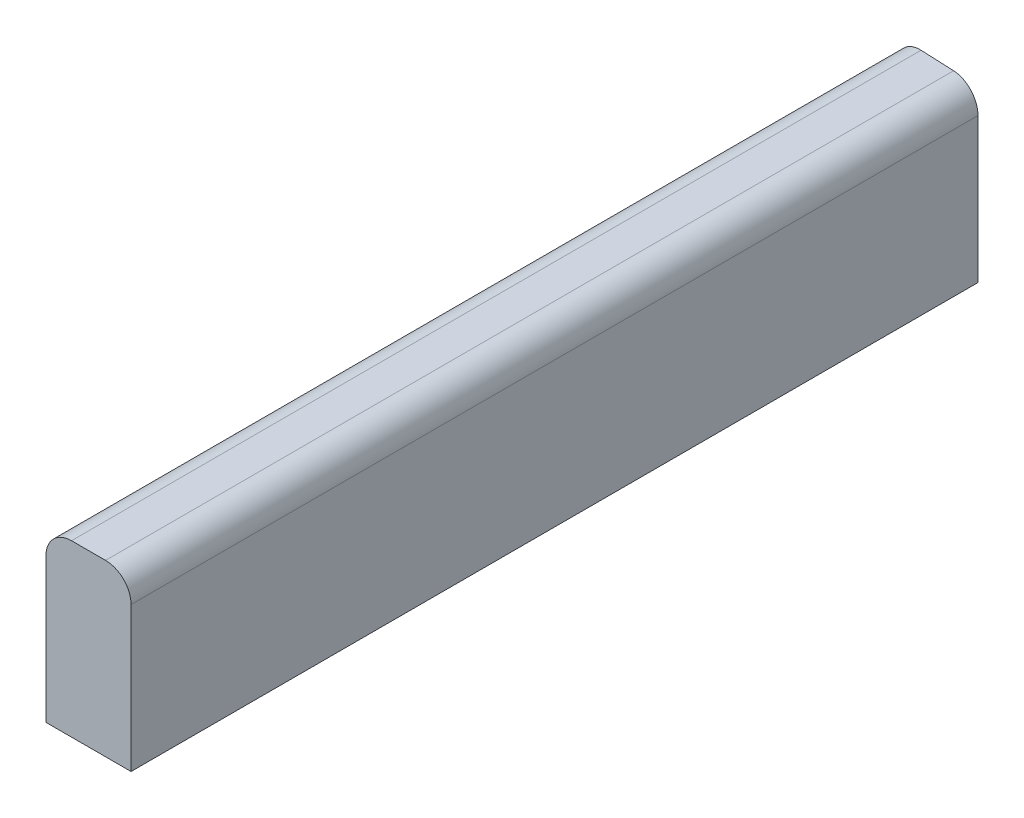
SolidWorks part; units mm, degrees
ref_plane "Ebene vorne" through (0, 0, 0) normal (0, 0, 1) x (1, 0, 0)
ref_plane "Ebene oben" through (0, 0, 0) normal (0, 1, 0) x (1, 0, 0)
ref_plane "Ebene rechts" through (0, 0, 0) normal (1, 0, 0) x (0, 0, -1)
sketch "Skizze1" plane through (0, 0, 0) normal (0, 0, 1) x (1, 0, 0)
  line L1 (0, 0) -> (10, 0)
  line L2 (0, 0) -> (0, 17)
  line L3 (3, 20) -> (7, 20)
  line L4 (10, 0) -> (10, 17)
  arc A0 (0, 17) -> (3, 20) centre (3, 17) cw
  arc A1 (10, 17) -> (7, 20) centre (7, 17) ccw
  point P7 (0, 20)
  dimension "D3" = 3
  dimension "D1" = 10
  dimension "D2" = 20
extrude "Linear austragen1" add sketch "Skizze1" along normal blind 100
sketch "Skizze2" plane through (0, 20, 0) normal (0, 1, 0) x (1, 0, 0)
  line L0 (0, 0) -> (10, -0.4366)
  line L1 (10, -0.4366) -> (10, 0)
  line L2 (10, 0) -> (0, 0)
  line L3 (7, 0) -> (3, 0) construction
  line L4 (10, -100) -> (10, 0) construction
  line L5 (0, -100) -> (0, 0) construction
  dimension "D1" = 2.5
extrude "Schnitt-Linear austragen1" cut sketch "Skizze2" against normal through all
